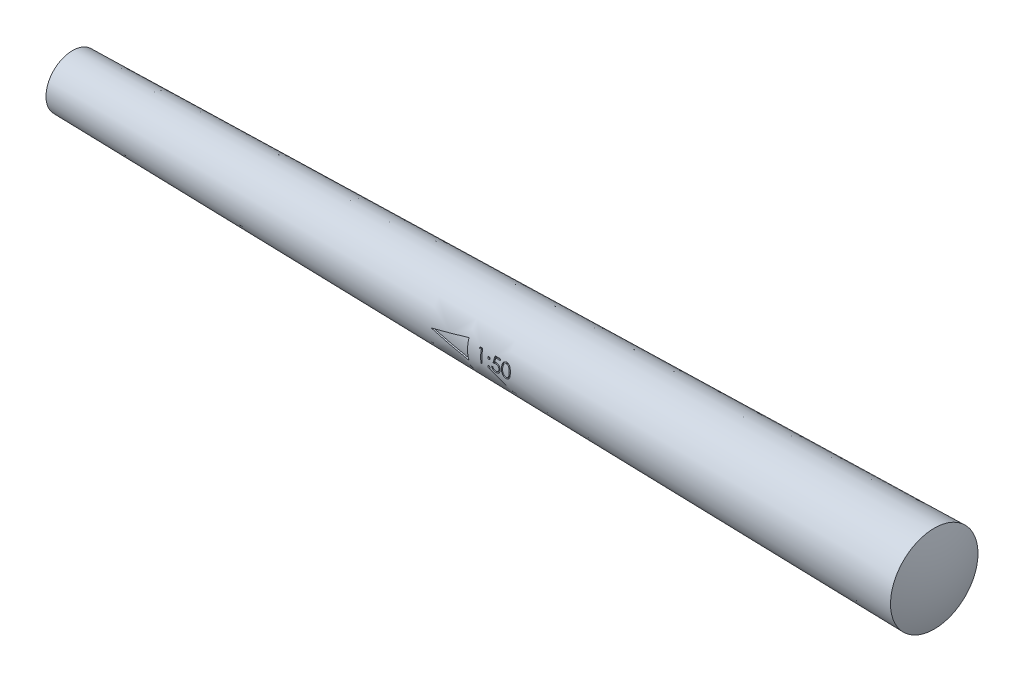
SolidWorks part; units mm, degrees
ref_plane "Front Plane" through (0, 0, 0) normal (0, 0, 1) x (1, 0, 0)
ref_plane "Top Plane" through (0, 0, 0) normal (0, 1, 0) x (1, 0, 0)
ref_plane "Right Plane" through (0, 0, 0) normal (1, 0, 0) x (0, 0, -1)
sketch "Sketch1" plane through (0, 0, 0) normal (1, 0, 0) x (0, 0, -1)
  circle A0 centre (0, 0) radius 2
  dimension "D1" = 4
extrude "Extrude1" add sketch "Sketch1" along normal mid plane 65
draft "Draft1" type of draft neutral plane draft angle 1.146 faces to draft 1 parameters "D1"=1.146
sketch "Sketch2" plane through (0, 0, 0) normal (0, 0, 1) x (1, 0, 0)
  line L0 (-32.5, 0) -> (-32.5, 2)
  line L1 (-32.5, 2) -> (-32.5, -2) construction
  line L2 (-32.5, 0) -> (-33.1, 0)
  line L3 (-33.1, 0) -> (-33.1, -2.65) construction
  line L4 (32.5, 0) -> (32.5, 3.3)
  line L5 (32.5, -3.3) -> (32.5, 3.3) construction
  line L6 (32.5, 0) -> (33.1, 0)
  line L7 (33.1, 0) -> (33.1, -2.65) construction
  line L8 (-32.5, -2) -> (32.5, -3.3) construction
  arc A0 (-33.1, 0) -> (-32.5, 2) centre (-29.4667, 0) cw
  arc A1 (33.1, 0) -> (32.5, 3.3) centre (23.7248, 0) ccw
  point P14 (0, -2.65)
revolve "Revolve1" add sketch "Sketch2" angle 360 about L2
sketch "Sketch5" plane through (0, 0, 0) normal (0, 0, 1) x (1, 0, 0)
  line L0 (0, 2.65) -> (0, -2.65) construction
  line L1 (32.5, 3.3) -> (-32.5, 2) construction
  line L2 (-32.5, -2) -> (32.5, -3.3) construction
ref_plane "Plane2" through (0, 0, 0) normal (-0.02, 0, 0.9998) x (0.9998, 0, 0.02)
sketch "Sketch6" plane through (0, 0, 0) normal (-0.02, 0, 0.9998) x (0.9998, 0, 0.02)
  line L0 (0, 0) -> (0, 0.75)
  line L1 (0, 2.65) -> (0, -2.65) construction
  line L2 (0, 0.75) -> (-2.799, 0)
  line L3 (-2.799, 0) -> (0, -0.75)
  line L4 (0, -0.75) -> (0, 0)
  line L5 (0, -0.375) -> (4, -0.375) construction
  text T0 "1:50" font "Century Gothic" height 1
  dimension "D1" = 1.5
  dimension "D2" = 30
  dimension "D3" = 4
wrap "Wrap2" sketch "Sketch6" wrap type deboss source sketch "Sketch6" thickness 0.1 parameters "D1"=0.1
equation "\"D2@Sketch2\" = \"D1@Sketch2\""
